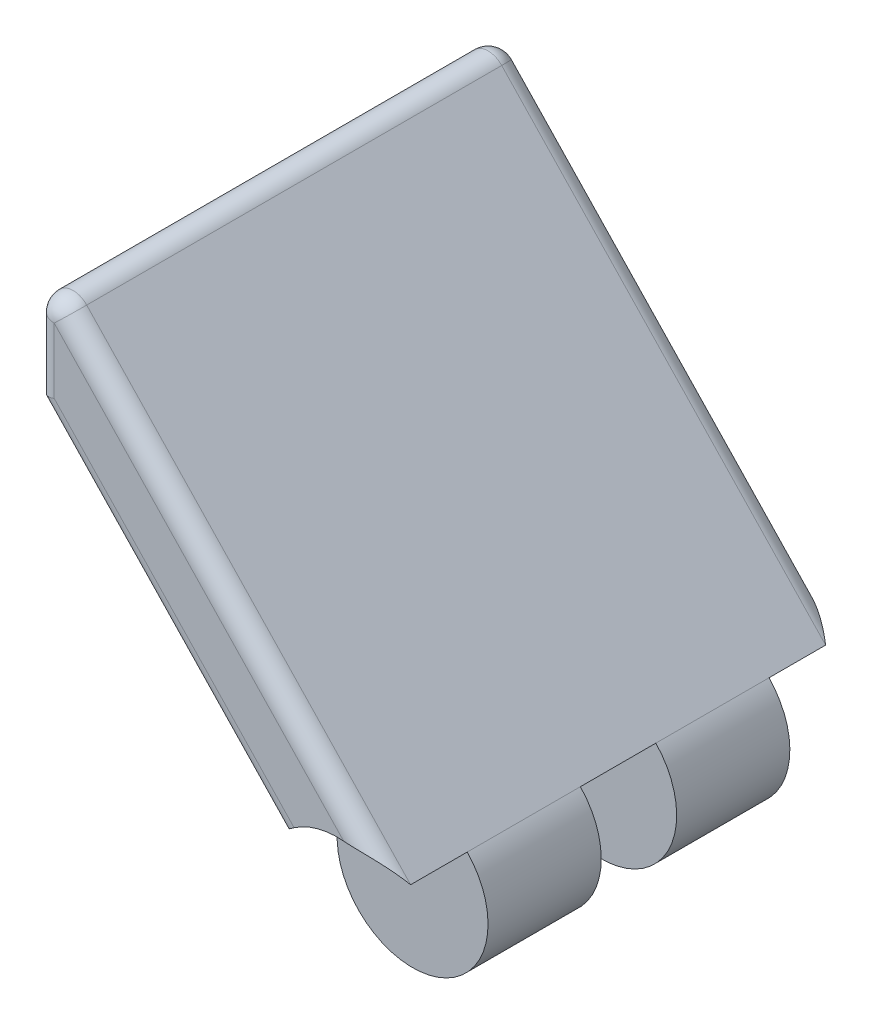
SolidWorks part; units mm, degrees
ref_plane "Front Plane" through (0, 0, 0) normal (0, 0, 1) x (1, 0, 0)
ref_plane "Top Plane" through (0, 0, 0) normal (0, 1, 0) x (1, 0, 0)
ref_plane "Right Plane" through (0, 0, 0) normal (1, 0, 0) x (0, 0, -1)
sketch "Sketch1" plane through (0, 0, 0) normal (0, 0, 1) x (1, 0, 0)
  line L3 (102.2774, 232.1001) -> (78.2794, 257.2905)
  line L5 (94.758, 231.9203) -> (85.7649, 241.3602)
  line L7 (78.2794, 257.2905) -> (78.2794, 249.2176)
  line L9 (78.2794, 249.2176) -> (85.7649, 241.3602)
  arc A0 (94.758, 231.9203) -> (102.2774, 232.1001) centre (98.5994, 228.5961) ccw
  dimension "D3" = 10.16
  dimension "D1" = 78.2794
  dimension "D2" = 85.7649
  dimension "D4" = 94.758
  dimension "D5" = 98.5994
  dimension "D6" = 102.2774
  dimension "D7" = 228.5961
extrude "Extrude1" add sketch "Sketch1" along normal mid plane 30.48
fillet "Fillet1" radius 1.27 9 edges at (98.7208, 223.5176, -15.24) (98.7208, 223.5176, 15.24) (78.2794, 253.254, -15.24) (90.2784, 244.6953, -15.24) (90.2784, 244.6953, 15.24) (78.2794, 257.2905, 0) (78.2794, 253.254, 15.24) (86.5187, 240.569, 15.24) (86.5187, 240.569, -15.24)
ref_plane "Plane7" through (0, 0, -2.54) normal (0, 0, 1) x (1, 0, 0)
ref_plane "Plane8" through (0, 0, 2.54) normal (0, 0, 1) x (1, 0, 0)
sketch "Sketch3" plane through (0, 0, -2.54) normal (0, 0, 1) x (1, 0, 0)
  circle A0 centre (98.5994, 228.5961) radius 5.08
  arc A1 (94.758, 231.9203) -> (102.2774, 232.1001) centre (98.5994, 228.5961) ccw construction
extrude "Extrude3" cut sketch "Sketch3" along normal blind 5.08
ref_plane "Plane9" through (0, 0, 10.16) normal (0, 0, 1) x (1, 0, 0)
ref_plane "Plane10" through (0, 0, -10.16) normal (0, 0, 1) x (1, 0, 0)
sketch "Sketch4" plane through (0, 0, 10.16) normal (0, 0, 1) x (1, 0, 0)
  circle A0 centre (98.5994, 228.5961) radius 5.08
  arc A1 (94.758, 231.9203) -> (102.2774, 232.1001) centre (98.5994, 228.5961) ccw construction
extrude "Extrude4" cut sketch "Sketch4" along normal through all
sketch "Sketch5" plane through (0, 0, -10.16) normal (0, 0, 1) x (1, 0, 0)
  circle A0 centre (98.5994, 228.5961) radius 5.08
  arc A1 (94.758, 231.9203) -> (102.2774, 232.1001) centre (98.5994, 228.5961) ccw construction
extrude "Extrude5" cut sketch "Sketch5" against normal through all
